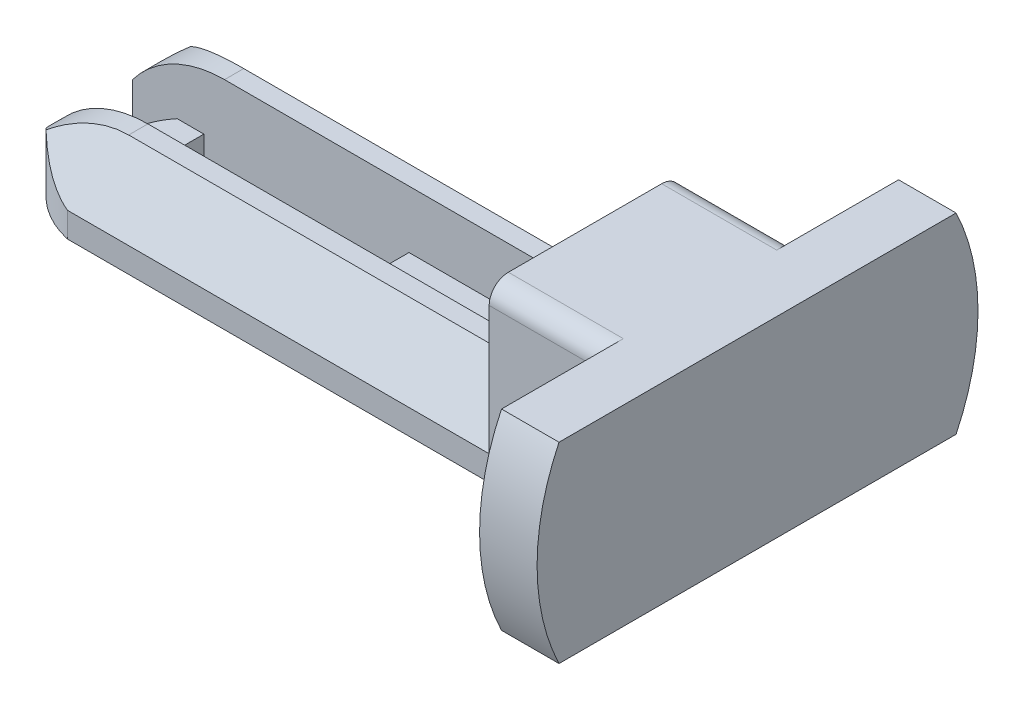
SolidWorks part; units mm, degrees
ref_plane "Front Plane" through (0, 0, 0) normal (0, 0, 1) x (1, 0, 0)
ref_plane "Top Plane" through (0, 0, 0) normal (0, 1, 0) x (1, 0, 0)
ref_plane "Right Plane" through (0, 0, 0) normal (1, 0, 0) x (0, 0, -1)
sketch "Sketch9" plane through (0, 0, 0) normal (0, 1, 0) x (1, 0, 0)
  line L1 (0, 0) -> (22, 0)
  line L3 (0, 10) -> (22, 10)
  line L4 (22, 0) -> (22, 10)
  arc A0 (0, 10) -> (0, 0) centre (1.125, 5) ccw
  dimension "D1" = 10
  dimension "D2" = 22
extrude "Boss-Extrude2" add sketch "Sketch9" along normal blind 2.3
ref_plane "Plane1" through (22, 0, 0) normal (1, 0, 0) x (0, 0, -1)
sketch "Sketch11" plane through (22, 0, 0) normal (1, 0, 0) x (0, 0, -1)
  line L0 (7, 5.3) -> (8, 5.3)
  line L1 (8, 5.3) -> (10, 2.3)
  line L2 (7, 2.3) -> (10, 2.3)
  line L3 (7, 5.3) -> (7, 2.3)
  dimension "D1" = 3
  dimension "D2" = 1
  dimension "D3" = 3
extrude "Boss-Extrude3" add sketch "Sketch11" against normal blind 26
sketch "Sketch12" plane through (22, 0, 0) normal (1, 0, 0) x (0, 0, -1)
  line L0 (0, 2.3) -> (0, 0) construction
  line L1 (3, 5.3) -> (2, 5.3)
  line L2 (3, 5.3) -> (3, 2.3)
  line L3 (2, 5.3) -> (0, 2.3)
  line L4 (0, 2.3) -> (3, 2.3)
  dimension "D1" = 3
  dimension "D2" = 3
  dimension "D3" = 1
extrude "Boss-Extrude4" add sketch "Sketch12" against normal blind 26
fillet "Fillet7" radius 6 1 edges at (-4, 5.3, -7.5)
sketch "Sketch14" plane through (0, 2.3, 0) normal (0, -1, 0) x (1, 0, 0)
  line L0 (-3.5936, -7) -> (-4, -7)
  line L1 (-4, -7) -> (-4, -10)
  line L2 (-4, -10) -> (0, -10)
  arc A0 (0, -10) -> (-3.5936, -7) centre (1.125, -5) cw
extrude "Cut-Extrude2" cut sketch "Sketch14" against normal blind 3
fillet "Fillet8" radius 6 1 edges at (-4, 5.3, -2.5)
sketch "Sketch15" plane through (0, 2.3, 0) normal (0, -1, 0) x (1, 0, 0)
  line L0 (0, 0) -> (-4, 0)
  line L1 (-4, 0) -> (-4, -3)
  line L2 (-4, -3) -> (-3.5936, -3)
  arc A0 (-3.5936, -3) -> (0, 0) centre (1.125, -5) cw
extrude "Cut-Extrude3" cut sketch "Sketch15" against normal blind 3
chamfer "Chamfer1" distance 1 angle 45 3 edges at (11, 0, 0) (11, 0, -10) (-4, 0, -5)
chamfer "Chamfer2" distance 2 angle 45 1 edges at (-4, 2.3, -5)
sketch "Sketch16" plane through (0, 0, 0) normal (0, -1, 0) x (1, 0, 0)
  line L0 (0.1172, -3) -> (10.1172, -3)
  line L1 (0.1172, -3) -> (0.1172, -7)
  line L2 (10.1172, -3) -> (10.1172, -7)
  line L3 (10.1172, -7) -> (0.1172, -7)
  dimension "D1" = 4
  dimension "D2" = 2
  dimension "D3" = 10
extrude "Cut-Extrude4" cut sketch "Sketch16" against normal blind 3
chamfer "Chamfer3" distance 3 angle 45 1 edges at (10.1172, 0, -5)
chamfer "Chamfer4" distance 1 angle 45 2 edges at (6.6172, 0, -3) (6.6172, 0, -7)
sketch "Sketch17" plane through (22, 0, 0) normal (1, 0, 0) x (0, 0, -1)
  line L0 (0, 0) -> (10, 0)
  line L1 (10, 0) -> (10, 10)
  line L2 (10, 10) -> (0, 10)
  line L3 (0, 10) -> (0, 0)
  line L4 (1, 0) -> (9, 0) construction
  point P12 (5, 0)
  point P14 (5, 0)
  dimension "D1" = 10
  dimension "D2" = 10
extrude "Boss-Extrude5" add sketch "Sketch17" along normal blind 6
sketch "Sketch18" plane through (28, 0, 0) normal (1, 0, 0) x (0, 0, -1)
  line L7 (15.3562, 0) -> (-5.3562, 0)
  line L8 (-5.3562, 10) -> (15.3562, 10)
  arc A1 (-5.3562, 10) -> (-5.3562, 0) centre (5, 5) ccw
  arc A2 (15.3562, 0) -> (15.3562, 10) centre (5, 5) ccw
  dimension "D1" = 23
extrude "Boss-Extrude6" add sketch "Sketch18" along normal blind 3
fillet "Fillet9" radius 1 4 edges
